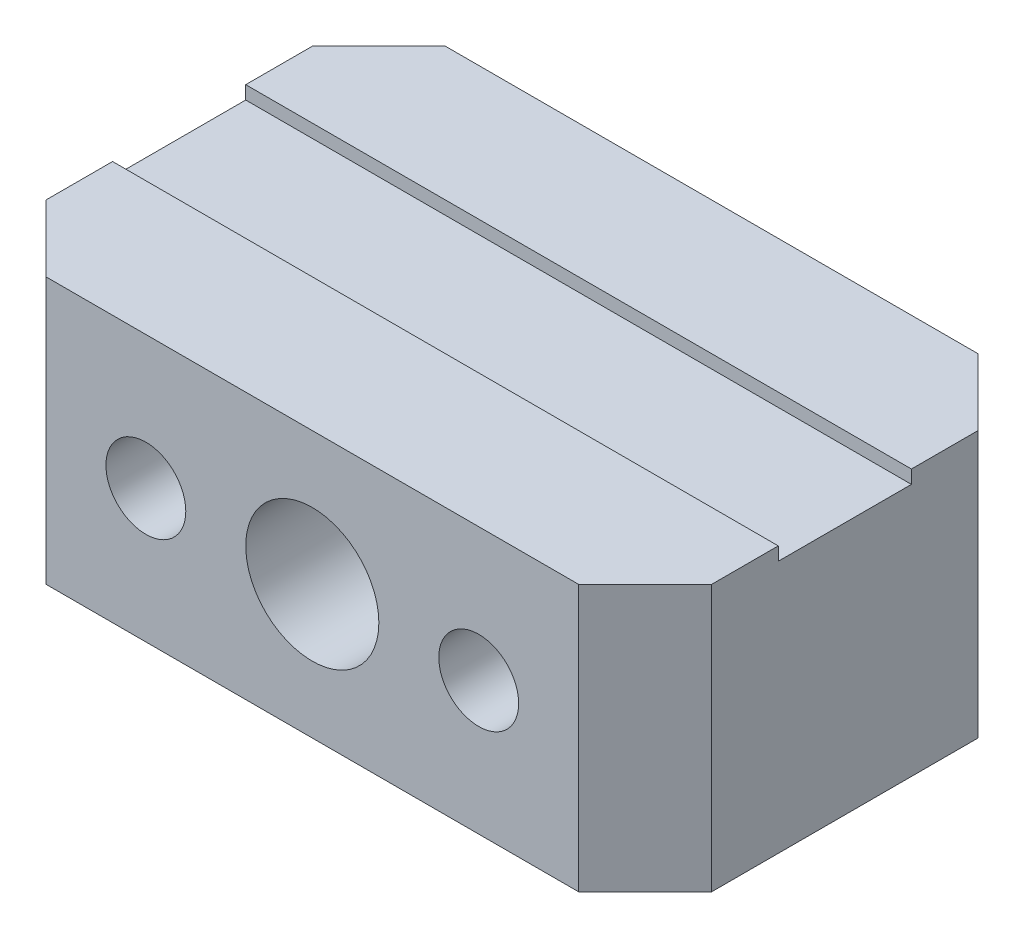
SolidWorks part; units mm, degrees
ref_plane "正面" through (0, 0, 0) normal (0, 0, 1) x (1, 0, 0)
ref_plane "平面" through (0, 0, 0) normal (0, 1, 0) x (1, 0, 0)
ref_plane "右側面" through (0, 0, 0) normal (1, 0, 0) x (0, 0, -1)
sketch "ｽｹｯﾁ1" plane through (0, 0, 0) normal (0, 0, 1) x (1, 0, 0)
  line L0 (-50, 20) -> (50, -20) construction
  line L1 (-50, 20) -> (50, 20)
  line L2 (-50, 20) -> (-50, -20)
  line L3 (-50, -20) -> (50, -20)
  line L4 (50, 20) -> (50, -20)
  line L5 (-50, -20) -> (50, 20) construction
  point P4 (0, 0)
  dimension "D1" = 100
  dimension "D2" = 40
extrude "押し出し1" add sketch "ｽｹｯﾁ1" along normal blind 60
sketch "ｽｹｯﾁ2" plane through (0, 0, 60) normal (0, 0, 1) x (1, 0, 0)
  circle A0 centre (0, 0) radius 10
  dimension "D1" = 20
extrude "ｶｯﾄ - 押し出し1" cut sketch "ｽｹｯﾁ2" against normal through all
sketch "ｽｹｯﾁ3" plane through (0, 0, 60) normal (0, 0, 1) x (1, 0, 0)
  line L0 (-25, 0) -> (25, 0) construction
  circle A0 centre (-25, 0) radius 6
  circle A1 centre (25, 0) radius 6
  dimension "D1" = 12
  dimension "D2" = 50
extrude "ｶｯﾄ - 押し出し2" cut sketch "ｽｹｯﾁ3" against normal through all
sketch "ｽｹｯﾁ4" plane through (0, 20, 0) normal (0, 1, 0) x (1, 0, 0)
  line L0 (-50, -60) -> (-50, 0) construction
  line L1 (-50, -20) -> (50, -20)
  line L2 (-50, -20) -> (-50, -40)
  line L3 (-50, -40) -> (50, -40)
  line L4 (50, -20) -> (50, -40)
  line L5 (50, -60) -> (50, 0) construction
  line L6 (50, 0) -> (-50, 0) construction
  dimension "D1" = 20
  dimension "D2" = 20
extrude "ｶｯﾄ - 押し出し3" cut sketch "ｽｹｯﾁ4" against normal blind 2
chamfer "面取り1" distance 10 angle 45 4 edges at (-50, 0, 0) (50, 0, 0) (-50, 0, 60) (50, 0, 60)
